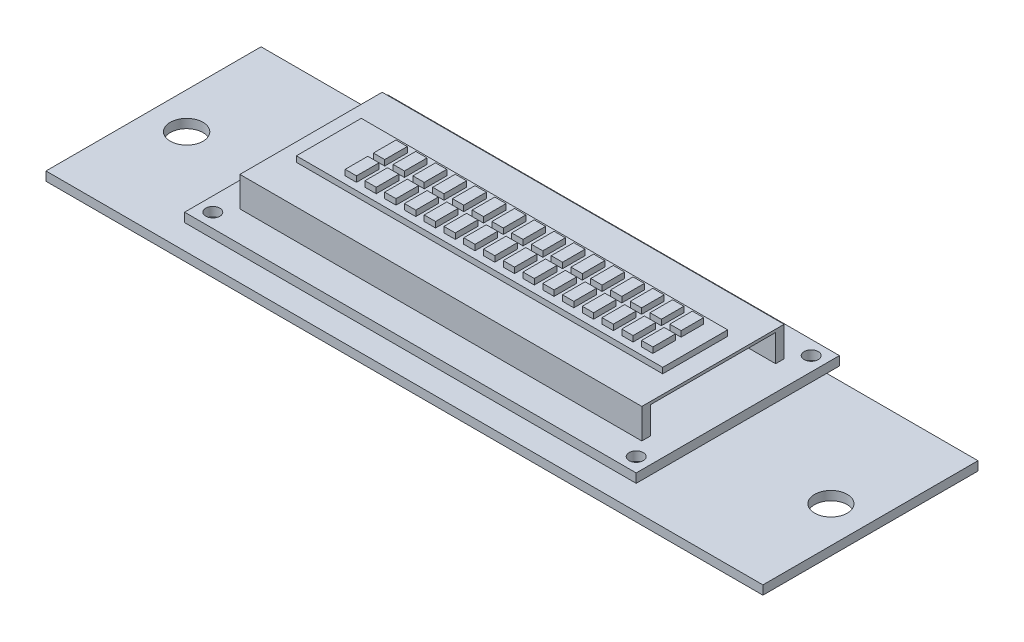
SolidWorks part; units mm, degrees
ref_plane "Front Plane" through (0, 0, 0) normal (0, 0, 1) x (1, 0, 0)
ref_plane "Top Plane" through (0, 0, 0) normal (0, 1, 0) x (1, 0, 0)
ref_plane "Right Plane" through (0, 0, 0) normal (1, 0, 0) x (0, 0, -1)
sketch "Sketch1" plane through (0, 0, 0) normal (0, 1, 0) x (1, 0, 0)
  line L1 (-40, -18) -> (40, -18)
  line L2 (-40, -18) -> (-40, 18)
  line L3 (-40, 18) -> (40, 18)
  line L4 (40, -18) -> (40, 18)
  line L5 (-40, -18) -> (40, 18) construction
  line L6 (-40, 18) -> (40, -18) construction
  point P0 (0, 0)
  dimension "D1" = 80
  dimension "D2" = 36
extrude "Boss-Extrude1" add sketch "Sketch1" along normal blind 1.6
sketch "Sketch2" plane through (0, 1.6, 0) normal (0, 1, 0) x (1, 0, 0)
  line L2 (40, 18) -> (-40, 18) construction
  line L3 (-40, 18) -> (-40, -18) construction
  line L5 (0, -0.88) -> (0, 0.88) construction
  line L6 (-0.88, 0) -> (0.88, 0) construction
  circle A0 centre (-37.5, 15.5) radius 2.5
  circle A1 centre (-37.5, 15.5) radius 1.25
  circle A2 centre (37.5, 15.5) radius 1.25
  circle A3 centre (37.5, 15.5) radius 2.5
  circle A4 centre (37.5, -15.5) radius 2.5
  circle A5 centre (37.5, -15.5) radius 1.25
  circle A6 centre (-37.5, -15.5) radius 1.25
  circle A7 centre (-37.5, -15.5) radius 2.5
  dimension "D1" = 5
  dimension "D2" = 2.5
extrude "Cut-Extrude1" cut sketch "Sketch2" against normal blind 1.6 contours A1 | A6 | A5 | A2
sketch "Sketch3" plane through (0, 1.6, 0) normal (0, 1, 0) x (1, 0, 0)
  line L1 (-35.6, -12.6) -> (35.6, -12.6)
  line L2 (-35.6, -12.6) -> (-35.6, 12.6)
  line L3 (-35.6, 12.6) -> (35.6, 12.6)
  line L4 (35.6, -12.6) -> (35.6, 12.6)
  line L5 (-35.6, -12.6) -> (35.6, 12.6) construction
  line L6 (-35.6, 12.6) -> (35.6, -12.6) construction
  point P0 (0, 0)
  dimension "D1" = 25.2
  dimension "D2" = 71.2
ref_plane "Plane1" through (0, 6.4, 0) normal (0, 1, 0) x (1, 0, 0)
sketch "Sketch4" plane through (0, 6.4, 0) normal (0, 1, 0) x (1, 0, 0)
  line L0 (35.6, -12.6) -> (35.6, 12.6) construction
  line L1 (-35.6, -12.6) -> (-35.6, 12.6) construction
  line L2 (-35.6, -12.6) -> (35.6, -12.6) construction
  line L3 (-35.6, -12.6) -> (35.6, 12.6) construction
  line L4 (-35.6, 12.6) -> (35.6, 12.6) construction
  line L5 (-35.6, 12.6) -> (35.6, -12.6) construction
  line L6 (35.6, -12.6) -> (35.6, 12.6)
  line L7 (-35.6, -12.6) -> (-35.6, 12.6)
  line L8 (-35.6, -12.6) -> (35.6, -12.6)
  line L9 (-35.6, -12.6) -> (35.6, 12.6) construction
  line L10 (-35.6, 12.6) -> (35.6, 12.6)
  line L11 (-35.6, 12.6) -> (35.6, -12.6) construction
  point P4 (0, 0)
extrude "Boss-Extrude2" add sketch "Sketch4" along normal blind 0.5 separate body
sketch "Sketch6" plane through (0, 6.4, 0) normal (0, -1, 0) x (1, 0, 0)
  line L0 (-35.6, -12.6) -> (-35.6, 12.6) construction
  line L1 (35.6, 11.1) -> (-35.6, 11.1)
  line L3 (35.6, -11.1) -> (-35.6, -11.1)
  line L5 (35.6, 11.1) -> (-35.6, -11.1) construction
  line L6 (35.6, -11.1) -> (-35.6, 11.1) construction
  line L7 (35.6, -12.6) -> (-35.6, -12.6) construction
  line L8 (-35.6, 12.6) -> (35.6, 12.6) construction
  line L10 (35.6, 12.6) -> (35.6, -12.6) construction
  line L11 (-35.6, 11.1) -> (35.6, 11.1)
  line L12 (-35.6, 11.1) -> (-35.6, 12.6)
  line L13 (-35.6, 12.6) -> (35.6, 12.6)
  line L14 (35.6, 11.1) -> (35.6, 12.6)
  line L16 (35.6, -11.1) -> (-35.6, -11.1)
  line L17 (35.6, -11.1) -> (35.6, -12.6)
  line L18 (35.6, -12.6) -> (-35.6, -12.6)
  line L19 (-35.6, -11.1) -> (-35.6, -12.6)
  point P0 (0, 0)
  dimension "D1" = 1.5
  dimension "D2" = 1.5
extrude "Boss-Extrude3" add sketch "Sketch6" along normal blind 9.7 contours L3 M16 M14 M15 | L1 M16 M13 M14
sketch "Sketch7" plane through (0, 6.9, 0) normal (0, 1, 0) x (1, 0, 0)
  line L0 (40, -18) -> (40, 18) construction
  line L1 (32.45, 5.75) -> (-32.45, 5.75)
  line L2 (32.45, 5.75) -> (32.45, -5.75)
  line L3 (32.45, -5.75) -> (-32.45, -5.75)
  line L4 (-32.45, 5.75) -> (-32.45, -5.75)
  line L5 (32.45, 5.75) -> (-32.45, -5.75) construction
  line L6 (32.45, -5.75) -> (-32.45, 5.75) construction
  point P0 (0, 0)
  dimension "D1" = 11.5
  dimension "D2" = 7.55
extrude "Boss-Extrude4" add sketch "Sketch7" along normal blind 1
sketch "Sketch8" plane through (0, 7.9, 0) normal (0, 1, 0) x (1, 0, 0)
  line L0 (-43.0161, 0) -> (37.7713, 0) construction
  line L1 (29.45, -0.5) -> (27.45, -0.5)
  line L2 (29.45, -0.5) -> (29.45, -4.5)
  line L3 (29.45, -4.5) -> (27.45, -4.5)
  line L4 (27.45, -0.5) -> (27.45, -4.5)
  line L5 (29.45, -0.5) -> (27.45, -4.5) construction
  line L6 (29.45, -4.5) -> (27.45, -0.5) construction
  line L7 (32.45, -5.75) -> (32.45, 5.75) construction
  line L8 (25.95, -0.5) -> (25.95, -4.5)
  line L9 (25.95, -0.5) -> (23.95, -0.5)
  line L10 (23.95, -0.5) -> (23.95, -4.5)
  line L11 (25.95, -4.5) -> (23.95, -4.5)
  line L12 (22.45, -0.5) -> (22.45, -4.5)
  line L13 (22.45, -0.5) -> (20.45, -0.5)
  line L14 (20.45, -0.5) -> (20.45, -4.5)
  line L15 (22.45, -4.5) -> (20.45, -4.5)
  line L16 (18.95, -0.5) -> (18.95, -4.5)
  line L17 (18.95, -0.5) -> (16.95, -0.5)
  line L18 (16.95, -0.5) -> (16.95, -4.5)
  line L19 (18.95, -4.5) -> (16.95, -4.5)
  line L20 (15.45, -0.5) -> (15.45, -4.5)
  line L21 (15.45, -0.5) -> (13.45, -0.5)
  line L22 (13.45, -0.5) -> (13.45, -4.5)
  line L23 (15.45, -4.5) -> (13.45, -4.5)
  line L24 (11.95, -0.5) -> (11.95, -4.5)
  line L25 (11.95, -0.5) -> (9.95, -0.5)
  line L26 (9.95, -0.5) -> (9.95, -4.5)
  line L27 (11.95, -4.5) -> (9.95, -4.5)
  line L28 (8.45, -0.5) -> (8.45, -4.5)
  line L29 (8.45, -0.5) -> (6.45, -0.5)
  line L30 (6.45, -0.5) -> (6.45, -4.5)
  line L31 (8.45, -4.5) -> (6.45, -4.5)
  line L32 (4.95, -0.5) -> (4.95, -4.5)
  line L33 (4.95, -0.5) -> (2.95, -0.5)
  line L34 (2.95, -0.5) -> (2.95, -4.5)
  line L35 (4.95, -4.5) -> (2.95, -4.5)
  line L36 (1.45, -0.5) -> (1.45, -4.5)
  line L37 (1.45, -0.5) -> (-0.55, -0.5)
  line L38 (-0.55, -0.5) -> (-0.55, -4.5)
  line L39 (1.45, -4.5) -> (-0.55, -4.5)
  line L40 (-2.05, -0.5) -> (-2.05, -4.5)
  line L41 (-2.05, -0.5) -> (-4.05, -0.5)
  line L42 (-4.05, -0.5) -> (-4.05, -4.5)
  line L43 (-2.05, -4.5) -> (-4.05, -4.5)
  line L44 (-5.55, -0.5) -> (-5.55, -4.5)
  line L45 (-5.55, -0.5) -> (-7.55, -0.5)
  line L46 (-7.55, -0.5) -> (-7.55, -4.5)
  line L47 (-5.55, -4.5) -> (-7.55, -4.5)
  line L48 (-9.05, -0.5) -> (-9.05, -4.5)
  line L49 (-9.05, -0.5) -> (-11.05, -0.5)
  line L50 (-11.05, -0.5) -> (-11.05, -4.5)
  line L51 (-9.05, -4.5) -> (-11.05, -4.5)
  line L52 (-12.55, -0.5) -> (-12.55, -4.5)
  line L53 (-12.55, -0.5) -> (-14.55, -0.5)
  line L54 (-14.55, -0.5) -> (-14.55, -4.5)
  line L55 (-12.55, -4.5) -> (-14.55, -4.5)
  line L56 (-16.05, -0.5) -> (-16.05, -4.5)
  line L57 (-16.05, -0.5) -> (-18.05, -0.5)
  line L58 (-18.05, -0.5) -> (-18.05, -4.5)
  line L59 (-16.05, -4.5) -> (-18.05, -4.5)
  line L60 (-19.55, -0.5) -> (-19.55, -4.5)
  line L61 (-19.55, -0.5) -> (-21.55, -0.5)
  line L62 (-21.55, -0.5) -> (-21.55, -4.5)
  line L63 (-19.55, -4.5) -> (-21.55, -4.5)
  line L64 (-23.05, -0.5) -> (-23.05, -4.5)
  line L65 (-23.05, -0.5) -> (-25.05, -0.5)
  line L66 (-25.05, -0.5) -> (-25.05, -4.5)
  line L67 (-23.05, -4.5) -> (-25.05, -4.5)
  line L68 (29.45, 4.5) -> (27.45, 0.5) construction
  line L69 (29.45, 0.5) -> (27.45, 4.5) construction
  line L70 (-23.05, 4.5) -> (-25.05, 4.5)
  line L71 (-25.05, 0.5) -> (-25.05, 4.5)
  line L72 (-23.05, 0.5) -> (-25.05, 0.5)
  line L73 (-23.05, 0.5) -> (-23.05, 4.5)
  line L74 (-19.55, 4.5) -> (-21.55, 4.5)
  line L75 (-21.55, 0.5) -> (-21.55, 4.5)
  line L76 (-19.55, 0.5) -> (-21.55, 0.5)
  line L77 (-19.55, 0.5) -> (-19.55, 4.5)
  line L78 (-16.05, 4.5) -> (-18.05, 4.5)
  line L79 (-18.05, 0.5) -> (-18.05, 4.5)
  line L80 (-16.05, 0.5) -> (-18.05, 0.5)
  line L81 (-16.05, 0.5) -> (-16.05, 4.5)
  line L82 (-12.55, 4.5) -> (-14.55, 4.5)
  line L83 (-14.55, 0.5) -> (-14.55, 4.5)
  line L84 (-12.55, 0.5) -> (-14.55, 0.5)
  line L85 (-12.55, 0.5) -> (-12.55, 4.5)
  line L86 (-9.05, 4.5) -> (-11.05, 4.5)
  line L87 (-11.05, 0.5) -> (-11.05, 4.5)
  line L88 (-9.05, 0.5) -> (-11.05, 0.5)
  line L89 (-9.05, 0.5) -> (-9.05, 4.5)
  line L90 (-5.55, 4.5) -> (-7.55, 4.5)
  line L91 (-7.55, 0.5) -> (-7.55, 4.5)
  line L92 (-5.55, 0.5) -> (-7.55, 0.5)
  line L93 (-5.55, 0.5) -> (-5.55, 4.5)
  line L94 (-2.05, 4.5) -> (-4.05, 4.5)
  line L95 (-4.05, 0.5) -> (-4.05, 4.5)
  line L96 (-2.05, 0.5) -> (-4.05, 0.5)
  line L97 (-2.05, 0.5) -> (-2.05, 4.5)
  line L98 (1.45, 4.5) -> (-0.55, 4.5)
  line L99 (-0.55, 0.5) -> (-0.55, 4.5)
  line L100 (1.45, 0.5) -> (-0.55, 0.5)
  line L101 (1.45, 0.5) -> (1.45, 4.5)
  line L102 (4.95, 4.5) -> (2.95, 4.5)
  line L103 (2.95, 0.5) -> (2.95, 4.5)
  line L104 (4.95, 0.5) -> (2.95, 0.5)
  line L105 (4.95, 0.5) -> (4.95, 4.5)
  line L106 (8.45, 4.5) -> (6.45, 4.5)
  line L107 (6.45, 0.5) -> (6.45, 4.5)
  line L108 (8.45, 0.5) -> (6.45, 0.5)
  line L109 (8.45, 0.5) -> (8.45, 4.5)
  line L110 (11.95, 4.5) -> (9.95, 4.5)
  line L111 (9.95, 0.5) -> (9.95, 4.5)
  line L112 (11.95, 0.5) -> (9.95, 0.5)
  line L113 (11.95, 0.5) -> (11.95, 4.5)
  line L114 (15.45, 4.5) -> (13.45, 4.5)
  line L115 (13.45, 0.5) -> (13.45, 4.5)
  line L116 (15.45, 0.5) -> (13.45, 0.5)
  line L117 (15.45, 0.5) -> (15.45, 4.5)
  line L118 (18.95, 4.5) -> (16.95, 4.5)
  line L119 (16.95, 0.5) -> (16.95, 4.5)
  line L120 (18.95, 0.5) -> (16.95, 0.5)
  line L121 (18.95, 0.5) -> (18.95, 4.5)
  line L122 (22.45, 4.5) -> (20.45, 4.5)
  line L123 (20.45, 0.5) -> (20.45, 4.5)
  line L124 (22.45, 0.5) -> (20.45, 0.5)
  line L125 (22.45, 0.5) -> (22.45, 4.5)
  line L126 (25.95, 4.5) -> (23.95, 4.5)
  line L127 (23.95, 0.5) -> (23.95, 4.5)
  line L128 (25.95, 0.5) -> (23.95, 0.5)
  line L129 (25.95, 0.5) -> (25.95, 4.5)
  line L130 (27.45, 0.5) -> (27.45, 4.5)
  line L131 (29.45, 4.5) -> (27.45, 4.5)
  line L132 (29.45, 0.5) -> (29.45, 4.5)
  line L133 (29.45, 0.5) -> (27.45, 0.5)
  point P0 (28.45, -2.5)
  point P134 (28.45, 2.5)
  dimension "D1" = 0.5
  dimension "D2" = 4
  dimension "D3" = 2
  dimension "D4" = 4
  dimension "D5" = 16
extrude "Boss-Extrude5" add sketch "Sketch8" along normal blind 1 contours L11 L8 L9 L10 | L15 L12 L13 L14 | L124 L125 L122 L123 | L128 L129 L126 L127 | L133 L132 L131 L130 | L120 L121 L118 L119 | L19 L16 L17 L18 | L23 L20 L21 L22 | L116 L117 L114 L115 | L112 L113 L110 L111 | L27 L24 L25 L26 | L31 L28 L29 L30 | L108 L109 L106 L107 | L104 L105 L102 L103 | L35 L32 L33 L34 | L39 L36 L37 L38 | L100 L101 L98 L99 | L96 L97 L94 L95 | L43 L40 L41 L42 | L47 L44 L45 L46 | L88 L89 L86 L87 | L92 L93 L90 L91 | L51 L48 L49 L50 | L55 L52 L53 L54 | L84 L85 L82 L83 | L80 L81 L78 L79 | L59 L56 L57 L58 | L63 L60 L61 L62 | L76 L77 L74 L75 | L72 L73 L70 L71 | L67 L64 L65 L66 | L2 L1 L4 L3
sketch "Sketch9" plane through (0, -3.3, 0) normal (0, -1, 0) x (1, 0, 0)
  line L1 (-63.5, 19.05) -> (63.5, 19.05)
  line L2 (-63.5, 19.05) -> (-63.5, -19.05)
  line L3 (-63.5, -19.05) -> (63.5, -19.05)
  line L4 (63.5, 19.05) -> (63.5, -19.05)
  line L5 (-63.5, 19.05) -> (63.5, -19.05) construction
  line L6 (-63.5, -19.05) -> (63.5, 19.05) construction
  point P0 (0, 0)
  dimension "D1" = 127
  dimension "D2" = 38.1
extrude "Boss-Extrude6" add sketch "Sketch9" along normal blind 1.5875
sketch "Sketch11" plane through (0, -3.3, 0) normal (0, 1, 0) x (1, 0, 0)
  circle A0 centre (57.0747, -0.5782) radius 2.8882
  circle A1 centre (-57.0616, -0.5782) radius 2.9056
extrude "Cut-Extrude2" cut sketch "Sketch11" against normal up to next (1.5875 mm away)
